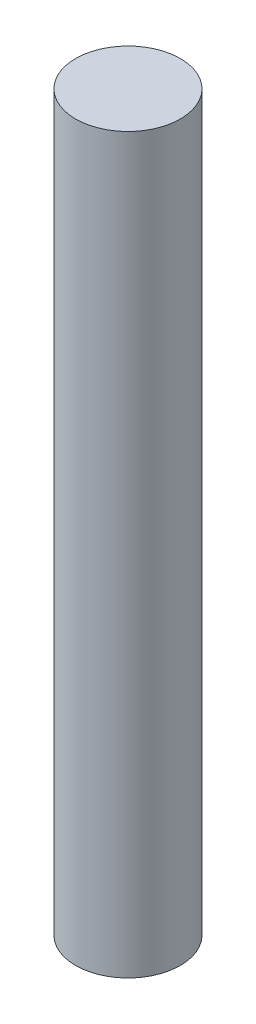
SolidWorks part; units mm, degrees
ref_plane "Plan de face" through (0, 0, 0) normal (0, 0, 1) x (1, 0, 0)
ref_plane "Plan de dessus" through (0, 0, 0) normal (0, 1, 0) x (1, 0, 0)
ref_plane "Plan de droite" through (0, 0, 0) normal (1, 0, 0) x (0, 0, -1)
sketch "Esquisse1" plane through (0, 0, 0) normal (0, 1, 0) x (1, 0, 0)
  circle A0 centre (0, 0) radius 0.25
  dimension "D1" = 0.5
extrude "Extrusion2" add sketch "Esquisse1" along normal blind 3.5
